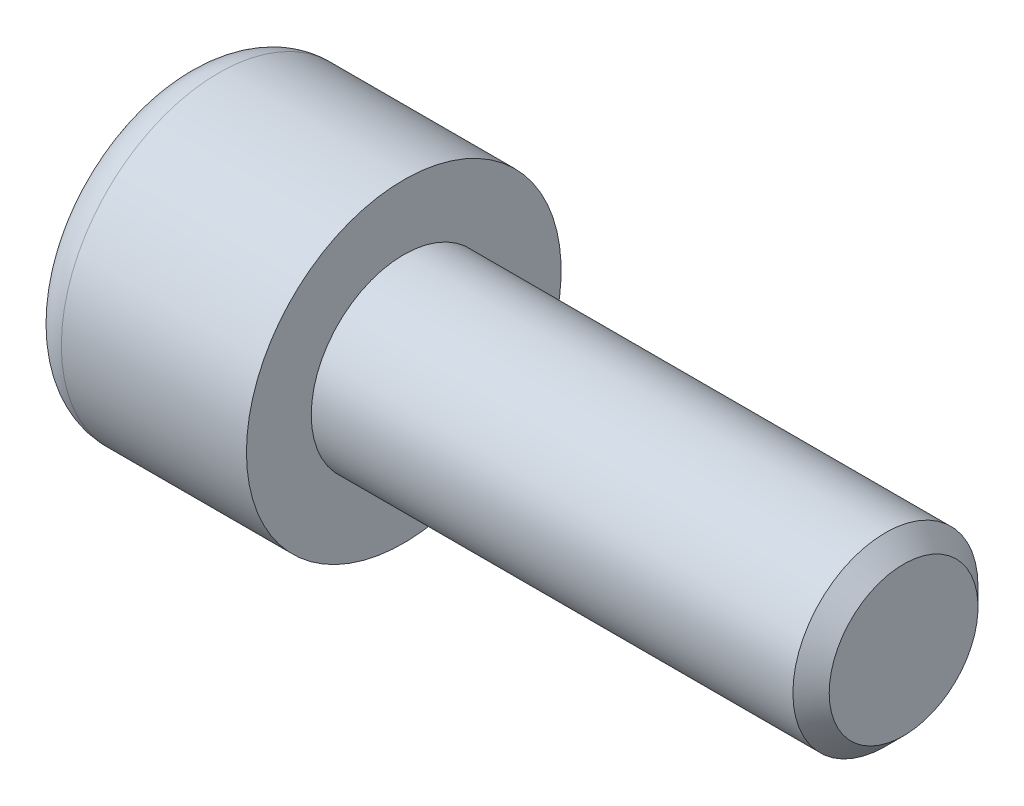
SolidWorks part; units mm, degrees
ref_plane "Front" through (0, 0, 0) normal (0, 0, 1) x (1, 0, 0)
ref_plane "Top" through (0, 0, 0) normal (0, 1, 0) x (1, 0, 0)
ref_plane "Right" through (0, 0, 0) normal (1, 0, 0) x (0, 0, -1)
imported_body "262005x16"
sketch "Schizzo1" plane through (0, 0, 0) normal (0, 1, 0) x (1, 0, 0)
  line L0 (3.5, 4.25) -> (6, 4.25)
  line L1 (6, 4.25) -> (6, 0)
  line L2 (6, 0) -> (3.5, 0)
  line L3 (3.5, -4.25) -> (3.5, 4.25) construction
  line L4 (3.5, 0) -> (3.5, 4.25)
  line L5 (6, 0) -> (16.5, 0) construction
  line L6 (16.5, 0) -> (16.5, 2.5)
  line L7 (16.5, 2.5) -> (17.5095, 2.5)
  line L8 (17.5095, 2.5) -> (18, 2.0095)
  line L9 (18, 2.0095) -> (18, 0)
  line L10 (18, 0) -> (16.5, 0)
  line L11 (19.5, 2.0095) -> (19.0095, 2.5) construction
  line L12 (19.5, 2.0095) -> (19.0095, 2.5) construction
  line L13 (19.0095, 2.5) -> (3.5, 2.5) construction
  line L14 (0, 3.25) -> (0, -3.25) construction
  line L15 (19.5, -2.0095) -> (19.5, 2.0095) construction
  dimension "D1" = 6
  dimension "D2" = 12
  dimension "D3" = 3
revolve "Rivoluzione1" add sketch "Schizzo1" angle 360 about L5
